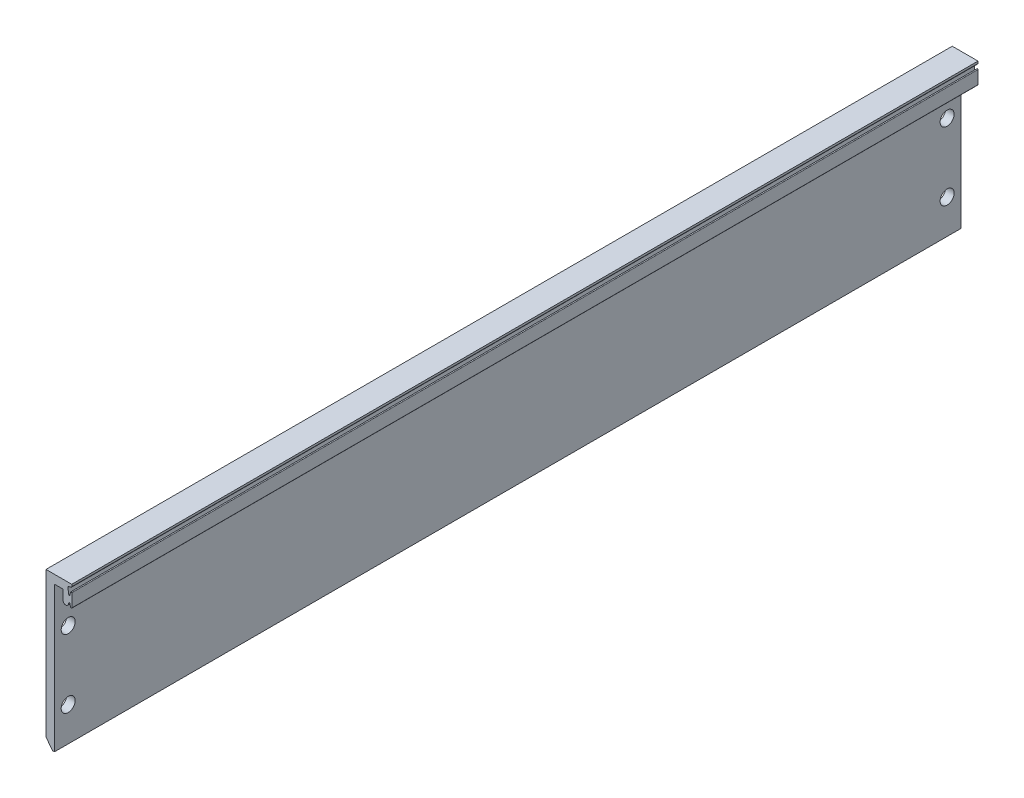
SolidWorks part; units mm, degrees
ref_plane "前视基准面" through (0, 0, 0) normal (0, 0, 1) x (1, 0, 0)
ref_plane "上视基准面" through (0, 0, 0) normal (0, 1, 0) x (1, 0, 0)
ref_plane "右视基准面" through (0, 0, 0) normal (1, 0, 0) x (0, 0, -1)
sketch "草图1" plane through (0, 0, 0) normal (0, 0, 1) x (1, 0, 0)
  line L3 (2260.201, -3063.3015) -> (2260.201, -3066.1678)
  line L4 (2262.741, -3060.8015) -> (2262.741, -3061.3761)
  line L6 (2261.7412, -3066.3727) -> (2261.8863, -3065.8372)
  line L7 (2262.1766, -3065.8405) -> (2262.4208, -3066.828)
  line L8 (2262.741, -3066.789) -> (2262.741, -3062.964)
  line L9 (2262.4208, -3062.925) -> (2262.1766, -3063.9125)
  line L10 (2261.9399, -3061.7612) -> (2262.489, -3061.6723)
  line L11 (2262.741, -3061.3761) -> (2262.741, -3060.8015)
  line L12 (2262.741, -3060.8015) -> (2255.201, -3060.8015)
  line L13 (2255.201, -3060.8015) -> (2255.201, -3103.3015)
  line L14 (2255.201, -3103.3015) -> (2257.101, -3105.8015)
  line L15 (2257.101, -3105.8015) -> (2257.701, -3105.8015)
  line L16 (2257.701, -3105.8015) -> (2257.701, -3063.3015)
  line L17 (2257.701, -3063.3015) -> (2260.201, -3063.3015)
  line L18 (2260.201, -3063.3015) -> (2260.201, -3066.1678)
  arc A0 (2260.201, -3066.1678) -> (2261.7412, -3066.3727) centre (2260.9847, -3066.1678) ccw
  arc A1 (2262.1766, -3065.8405) -> (2261.8863, -3065.8372) centre (2262.031, -3065.8765) ccw
  arc A2 (2262.4208, -3066.828) -> (2262.741, -3066.789) centre (2262.5785, -3066.789) ccw
  arc A3 (2262.741, -3062.964) -> (2262.4208, -3062.925) centre (2262.5785, -3062.964) ccw
  arc A4 (2261.8821, -3063.894) -> (2262.1766, -3063.9125) centre (2262.031, -3063.8765) ccw
  arc A5 (2261.6881, -3062.0453) -> (2261.8821, -3063.894) centre (2268.1291, -3062.304) ccw
  arc A6 (2261.9399, -3061.7612) -> (2261.6881, -3062.0453) centre (2261.9878, -3062.0573) ccw
  arc A7 (2262.489, -3061.6723) -> (2262.741, -3061.3761) centre (2262.441, -3061.3761) ccw
extrude "凸台-拉伸1" add sketch "草图1" along normal mid plane 265.35 contours L10 A7 L4 L12 L13 L14 L15 L16 L17 L3 A0 L6 A1 L7 A2 L8 A3 L9 A4 A5 A6
sketch "草图2" plane through (2255.201, 0, 0) normal (-1, 0, 0) x (0, 0, 1)
  line L0 (132.675, -3060.8015) -> (-132.675, -3060.8015) construction
  line L1 (-132.675, -3060.8015) -> (-132.675, -3103.3015) construction
  line L2 (0, -3060.8015) -> (0, -3105.8015) construction
  line L3 (132.675, -3105.8015) -> (-132.675, -3105.8015) construction
  circle A0 centre (-128.675, -3075.8015) radius 2.05
  circle A1 centre (-128.675, -3095.8015) radius 2.05
  circle A2 centre (128.675, -3095.8015) radius 2.05
  circle A3 centre (128.675, -3075.8015) radius 2.05
  dimension "D1" = 4.1
  dimension "D2" = 4.1
  dimension "D3" = 20
  dimension "D4" = 15
  dimension "D5" = 4
  dimension "D6" = 4
extrude "切除-拉伸1" cut sketch "草图2" against normal through all
sketch "草图3" plane through (2255.201, 0, 0) normal (-1, 0, 0) x (0, 0, 1)
  line L0 (-132.675, -3060.8015) -> (-132.675, -3103.3015) construction
  line L1 (132.675, -3060.8015) -> (-132.675, -3060.8015) construction
  circle A0 centre (-4.675, -3075.8015) radius 2.05
  circle A1 centre (4.675, -3075.8015) radius 2.05
  circle A2 centre (4.675, -3095.8015) radius 2.05
  circle A3 centre (-4.675, -3095.8015) radius 2.05
  point P4 (0, -3060.8015)
  dimension "D1" = 4.1
  dimension "D2" = 128
  dimension "D3" = 15
  dimension "D4" = 2
  dimension "D5" = 2
extrude "切除-拉伸2" [suppressed] cut sketch "草图3" against normal through all
equation "\"切除-拉伸2\" = if ( \"D1@凸台-拉伸1\" = 265.35 , \"unsuppressed\" , \"suppressed\" )"
